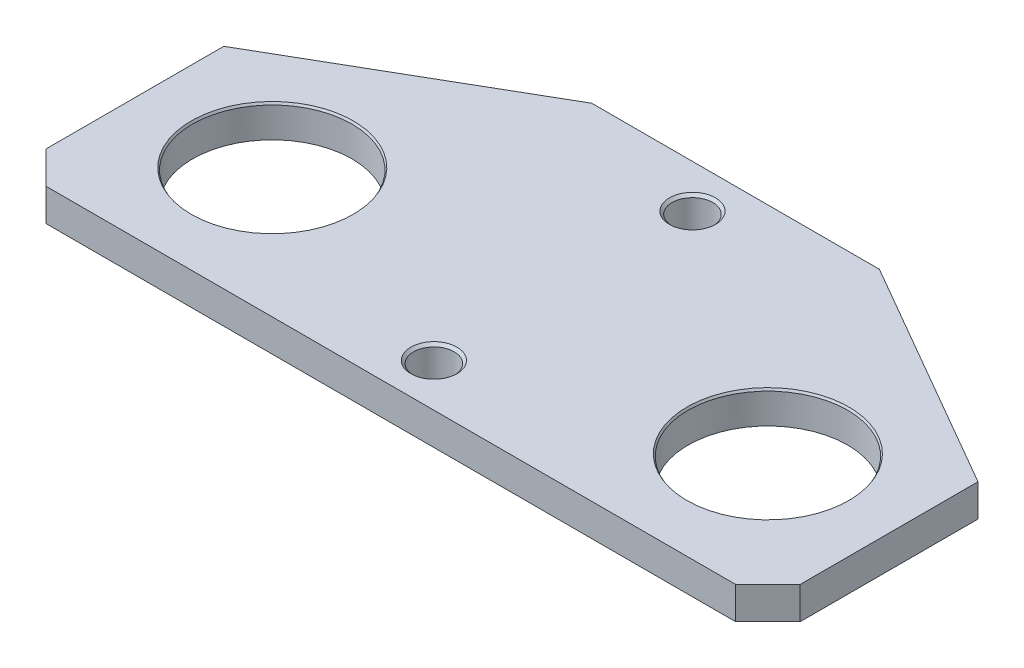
SolidWorks part; units mm, degrees
ref_plane "Front Plane" through (0, 0, 0) normal (0, 0, 1) x (1, 0, 0)
ref_plane "Top Plane" through (0, 0, 0) normal (0, 1, 0) x (1, 0, 0)
ref_plane "Right Plane" through (0, 0, 0) normal (1, 0, 0) x (0, 0, -1)
sketch "Sketch1" plane through (0, 0, 0) normal (0, 1, 0) x (1, 0, 0)
  line L0 (-73.025, -50.8) -> (73.025, -50.8) construction
  line L1 (-111.125, 12.7) -> (111.125, 12.7)
  line L2 (-111.125, 12.7) -> (-111.125, -88.9)
  line L3 (-111.125, -88.9) -> (111.125, -88.9)
  line L4 (111.125, 12.7) -> (111.125, -88.9)
  line L5 (0, 0) -> (0, -50.8) construction
  line L6 (0, 0) -> (0, 12.7) construction
  circle A0 centre (-73.025, -50.8) radius 23.5
  circle A1 centre (73.025, -50.8) radius 23.5
  circle A2 centre (0, 0) radius 6
  circle A3 centre (0, -76.2) radius 6
  dimension "D1" = 47
  dimension "D2" = 38.1
  dimension "D3" = 12
  dimension "D6" = 101.6
  dimension "D8" = 25.4
  dimension "D9" = 12.7
  dimension "D4" = 50.8
  dimension "D5" = 146.05
  dimension "D7" = 38.1
extrude "Boss-Extrude1" add sketch "Sketch1" along normal mid plane 9.525
sketch "Sketch2" plane through (0, 4.7625, 0) normal (0, 1, 0) x (1, 0, 0)
  circle A0 centre (73.025, -50.8) radius 28.575
  circle A1 centre (-73.025, -50.8) radius 28.575
  dimension "D1" = 57.15
extrude "Cut-Extrude1" [suppressed] cut sketch "Sketch2" against normal blind 3.175
chamfer "Chamfer1" distance 9.525 angle 45 2 edges at (111.125, 0, 88.9) (-111.125, 0, 88.9)
chamfer "Chamfer2" distance 0.635 angle 30 2 edges at (-73.025, 4.7625, 74.3) (73.025, 4.7625, 74.3)
chamfer "Chamfer4" distance 39.6875 angle 60 2 edges at (-111.125, 0, -12.7) (111.125, 0, -12.7)
chamfer "Chamfer5" distance 0.7937 angle 45 2 edges at (0, 4.7625, 82.2) (0, 4.7625, 6)
